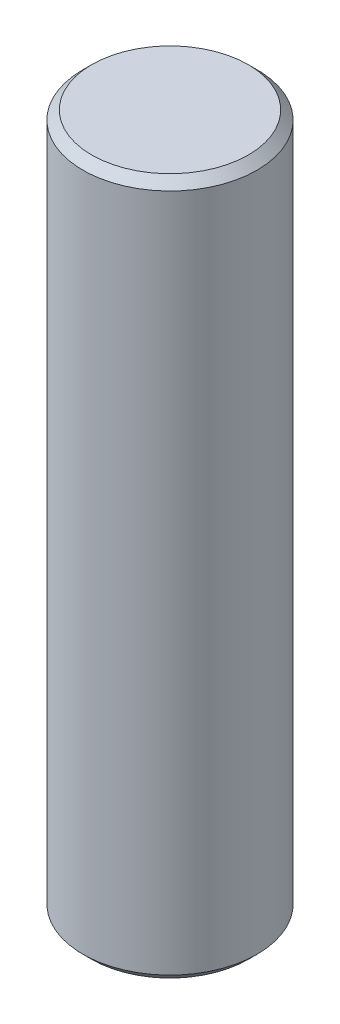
SolidWorks part; units mm, degrees
ref_plane "Front Plane" through (0, 0, 0) normal (0, 0, 1) x (1, 0, 0)
ref_plane "Top Plane" through (0, 0, 0) normal (0, 1, 0) x (1, 0, 0)
ref_plane "Right Plane" through (0, 0, 0) normal (1, 0, 0) x (0, 0, -1)
sketch "Sketch1" plane through (0, 0, 0) normal (0, 0, 1) x (1, 0, 0)
  line L0 (0, 127) -> (0, 0) construction
  line L2 (0, 0) -> (15.875, 0)
  line L3 (0, 0) -> (0, 127)
  line L4 (0, 127) -> (15.875, 127)
  line L5 (15.875, 0) -> (15.875, 127)
  dimension "D" = 31.75
  dimension "L" = 127
revolve "Revolve1" add sketch "Sketch1" angle 360 about L0
chamfer "Chamfer1" distance 1.6002 angle 45 2 edges at (-15.875, 0, 0) (-15.875, 127, 0)
hole_wizard "3/8-16 Tapped Hole1" positions "Sketch3" profile "Sketch2" tap size "3/8-16" standard "ANSI Inch"
sketch "Sketch3" plane through (0, 0, 0) normal (0, -1, 0) x (-1, 0, 0)
  point P0 (0, 0)
sketch "Sketch2" plane through (0, 0, 0) normal (1, 0, 0) x (0, 0, -1)
  line L0 (0, 0) -> (0, 23.0222)
  line L1 (0, 23.0222) -> (3.9687, 20.6375)
  line L2 (3.9687, 20.6375) -> (3.9687, 0)
  line L5 (3.9687, 0) -> (0, 0)
  line L10 (0, 23.0222) -> (-3.9688, 20.6375) construction
  line L11 (0, -6.35) -> (0, 107.95) construction
  dimension "Tap Drill Dia." = 7.9375
  dimension "Tap Drill Depth" = 20.6375
  dimension "Drill Angle" = 118
ref_plane "Plane1" through (0, 63.5, 0) normal (0, 1, 0) x (1, 0, 0)
hole_wizard "5/8-11 Tapped Hole1" positions "Sketch5" profile "Sketch4" tap size "5/8-11" standard "ANSI Inch"
sketch "Sketch5" plane through (0, 0, 0) normal (0, -1, 0) x (-1, 0, 0)
  point P0 (0, 0)
sketch "Sketch4" plane through (0, 0, 0) normal (1, 0, 0) x (0, 0, -1)
  line L0 (0, 0) -> (0, 42.7377)
  line L1 (0, 42.7377) -> (6.7462, 38.6842)
  line L2 (6.7462, 38.6842) -> (6.7462, 0)
  line L5 (6.7462, 0) -> (0, 0)
  line L10 (0, 42.7377) -> (-6.7462, 38.6842) construction
  line L11 (0, -6.35) -> (0, 107.95) construction
  dimension "Tap Drill Dia." = 13.4925
  dimension "Tap Drill Depth" = 38.6842
  dimension "Drill Angle" = 118
mirror "Mirror1" [suppressed] about plane through (0, 63.5, 0) normal (0, 1, 0)
mirror "Mirror2" [suppressed] about plane through (0, 63.5, 0) normal (0, 1, 0)
